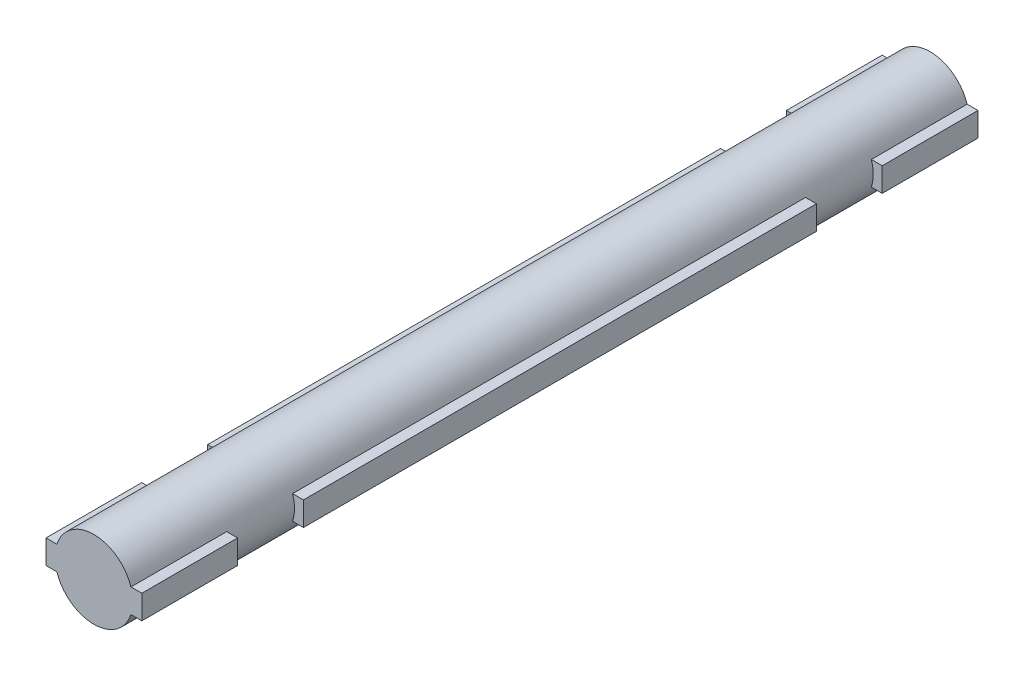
SolidWorks part; units mm, degrees
ref_plane "Face" through (0, 0, 0) normal (0, 0, 1) x (1, 0, 0)
ref_plane "Dessus" through (0, 0, 0) normal (0, 1, 0) x (1, 0, 0)
ref_plane "Droite" through (0, 0, 0) normal (1, 0, 0) x (0, 0, -1)
sketch "Esquisse1" plane through (0, 0, 0) normal (0, 0, 1) x (1, 0, 0)
  line L0 (0, 0) -> (3.0735, 0) construction
  line L1 (0, 0) -> (0, 2.4015) construction
  line L2 (2.4, 0.6) -> (1.8554, 0.6)
  line L3 (2.4, -0.6) -> (2.4, 0.6)
  line L4 (2.4, -0.6) -> (1.8554, -0.6)
  line L5 (-2.4, -0.6) -> (-1.8554, -0.6)
  line L6 (-2.4, -0.6) -> (-2.4, 0.6)
  line L7 (-2.4, 0.6) -> (-1.8554, 0.6)
  arc A0 (1.8554, 0.6) -> (-1.8554, 0.6) centre (0, 0) ccw
  arc A1 (-1.8554, -0.6) -> (1.8554, -0.6) centre (0, 0) ccw
  point P7 (2.4, 0)
  point P8 (-2.4, 0)
  dimension "D1" = 3.9
  dimension "D2" = 1.2
  dimension "D3" = 4.8
extrude "Extrusion1" add sketch "Esquisse1" along normal blind 41.9
sketch "Esquisse2" plane through (0, 0, 41.9) normal (0, 0, 1) x (1, 0, 0)
  circle A0 centre (0, 0) radius 1.95
extrude "Enlèv. mat.-Extru.1" cut sketch "Esquisse2" against normal blind 3.3 from offset 4.8 flip side to cut
ref_plane "Plan1" through (0, 0, 20.95) normal (0, 0, 1) x (1, 0, 0)
mirror "Symétrie1" about plane through (0, 0, 20.95) normal (0, 0, 1) of "Enlèv. mat.-Extru.1"
